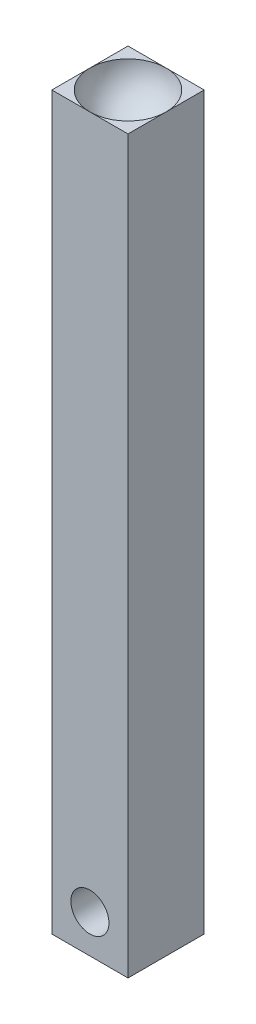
SolidWorks part; units mm, degrees
ref_plane "Front Plane" through (0, 0, 0) normal (0, 0, 1) x (1, 0, 0)
ref_plane "Top Plane" through (0, 0, 0) normal (0, 1, 0) x (1, 0, 0)
ref_plane "Right Plane" through (0, 0, 0) normal (1, 0, 0) x (0, 0, -1)
sketch "Sketch1" plane through (0, 0, 0) normal (0, 1, 0) x (1, 0, 0)
  line L1 (0, 0) -> (10, 0)
  line L2 (0, 0) -> (0, 10)
  line L3 (0, 10) -> (10, 10)
  line L4 (10, 0) -> (10, 10)
  dimension "D1" = 10
  dimension "D2" = 10
extrude "Boss-Extrude1" add sketch "Sketch1" along normal blind 96
ref_plane "Plane1" through (0, 0, -5) normal (0, 0, 1) x (1, 0, 0)
sketch "Sketch5" plane through (0, 0, -5) normal (0, 0, 1) x (1, 0, 0)
  line L0 (0, 96) -> (10, 96) construction
  line L1 (5, 96) -> (10, 96)
  line L2 (5, 96) -> (5, 91)
  arc A0 (5, 91) -> (10, 96) centre (5, 96) ccw
revolve "Cut-Revolve1" cut sketch "Sketch5" angle 360 about L2
sketch "Sketch6" plane through (0, 0, 0) normal (0, 0, 1) x (1, 0, 0)
  line L0 (5, 0) -> (5, 5) construction
  line L1 (0, 0) -> (10, 0) construction
  circle A0 centre (5, 5) radius 2.5
  dimension "D2" = 5
  dimension "D1" = 5
extrude "Cut-Extrude1" cut sketch "Sketch6" against normal blind 11
